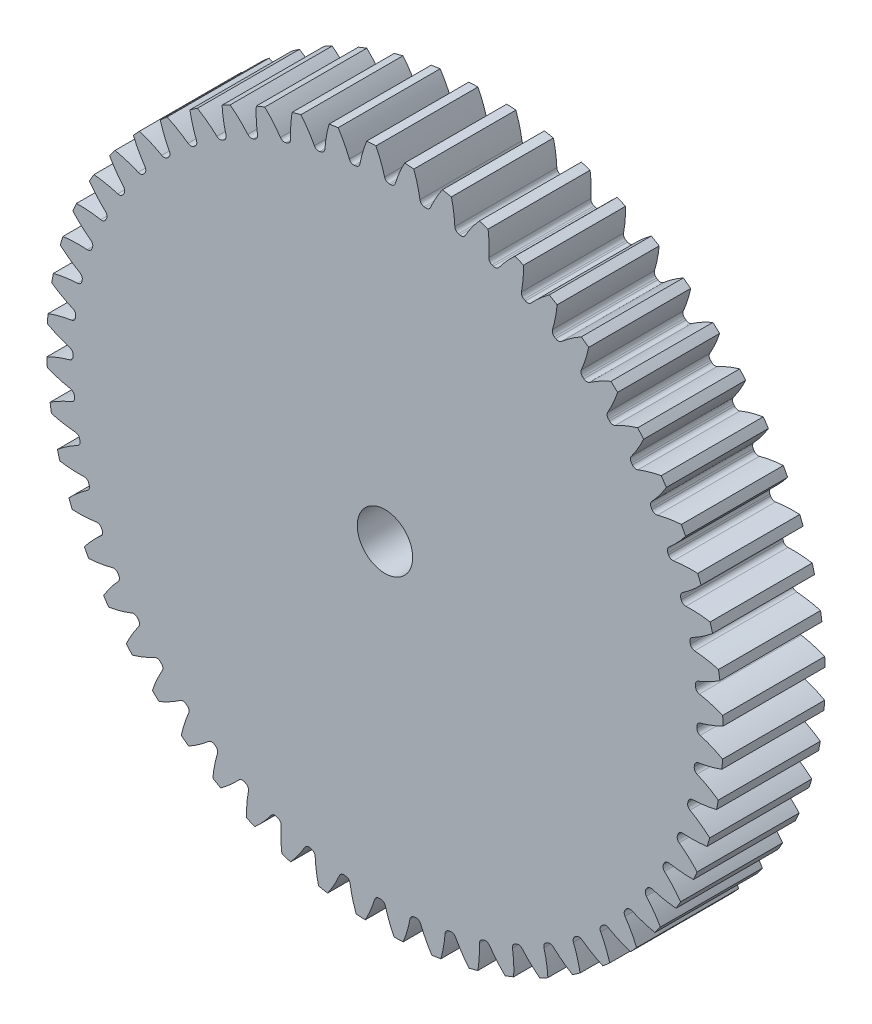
SolidWorks part; units mm, degrees
ref_plane "Front" through (0, 0, 0) normal (0, 0, 1) x (1, 0, 0)
ref_plane "Top" through (0, 0, 0) normal (0, 1, 0) x (1, 0, 0)
ref_plane "Right" through (0, 0, 0) normal (1, 0, 0) x (0, 0, -1)
sketch "Sketch3" plane through (0, 0, 0) normal (0, 0, 1) x (1, 0, 0)
  circle A0 centre (0, 0) radius 294.64
  dimension "od" = 589.28
extrude "gearBody" add sketch "Sketch3" along normal blind 88.9
sketch "Sketch2" plane through (0, 0, 0) normal (0, 0, 1) x (1, 0, 0)
  line L0 (0, 0) -> (246.9749, 102.3004) construction
  line L1 (294.2428, -17.2364) -> (0, 0) construction
  line L2 (0, 0) -> (36.3143, 0) construction
  line L3 (284.4589, 3.4635) -> (284.2083, -12.4303) construction
  line L5 (284.3336, -4.4834) -> (0, 0) construction
  line L7 (0, 0) -> (267.3238, 0) construction
  arc A0 (267.3199, -1.4294) -> (267.2321, -6.9995) centre (0, 0) ccw construction
  arc A1 (294.5341, 7.8975) -> (294.1387, -17.1797) centre (0, 0) ccw construction
  arc A2 (284.4589, 3.4635) -> (284.2083, -12.4303) centre (0, 0) ccw construction
  arc A3 (271.7348, -4.9583) -> (271.756, -3.6115) centre (0, 0) ccw
  arc A4 (294.2428, -17.2364) -> (274.6554, -8.9867) centre (243.6268, -110.0362) ccw
  arc A5 (294.2428, -17.2364) -> (294.64, 7.9509) centre (0, 0) ccw
  arc A6 (294.64, 7.9509) -> (274.8022, 0.3228) centre (246.9749, 102.3004) cw
  arc A7 (271.756, -3.6115) -> (274.8022, 0.3228) centre (275.8908, -3.6665) cw
  arc A8 (274.6554, -8.9867) -> (271.7348, -4.9583) centre (275.8692, -5.0337) cw
  point P6 (294.64, 7.9509)
  point P22 (294.2428, -17.2364)
  dimension "baseDia" = 534.6475
  dimension "od" = 589.28
  dimension "pd" = 568.96
  dimension "rd" = 543.56
  dimension "rFillet" = 4.1351
  dimension "pointX" = 294.64
  dimension "pointY" = 7.9509
  dimension "CTT" = 15.8937
  dimension "flankCenterAngle" = 22.5
extrude "toothCut" cut sketch "Sketch2" along normal through all
pattern_circular "CirPattern1" count 56 over 360 about axis through (0, 0, 0) along (0, 0, 1) of "toothCut"
sketch "hub1Dia" plane through (0, 0, 0) normal (0, 0, -1) x (-1, 0, 0)
  circle A0 centre (0, 0) radius 12.7
  dimension "hub1Dia" = 25.4
sketch "hub2Dia" plane through (0, 0, 88.9) normal (0, 0, 1) x (1, 0, 0)
  circle A0 centre (0, 0) radius 12.7
  dimension "hub2dia" = 25.4
sketch "boreDia" plane through (0, 0, 0) normal (0, 0, 1) x (1, 0, 0)
  circle A0 centre (0, 0) radius 24.13
  dimension "boreDia" = 48.26
extrude "bore" cut sketch "boreDia" against normal mid plane 25400
